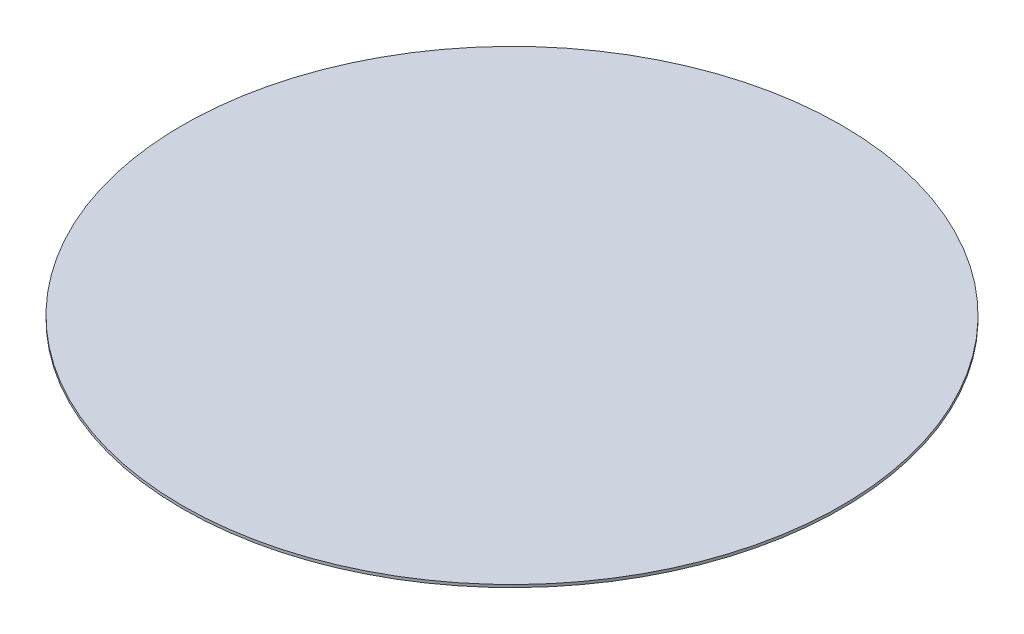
SolidWorks part; units mm, degrees
ref_plane "Alzado" through (0, 0, 0) normal (0, 0, 1) x (1, 0, 0)
ref_plane "Planta" through (0, 0, 0) normal (0, 1, 0) x (1, 0, 0)
ref_plane "Vista lateral" through (0, 0, 0) normal (1, 0, 0) x (0, 0, -1)
sketch "Croquis4" plane through (0, 0, 0) normal (0, 1, 0) x (1, 0, 0)
  circle A0 centre (0, 0) radius 247
  dimension "D1" = 494
extrude "Saliente-Extruir1" add sketch "Croquis4" along normal blind 2
